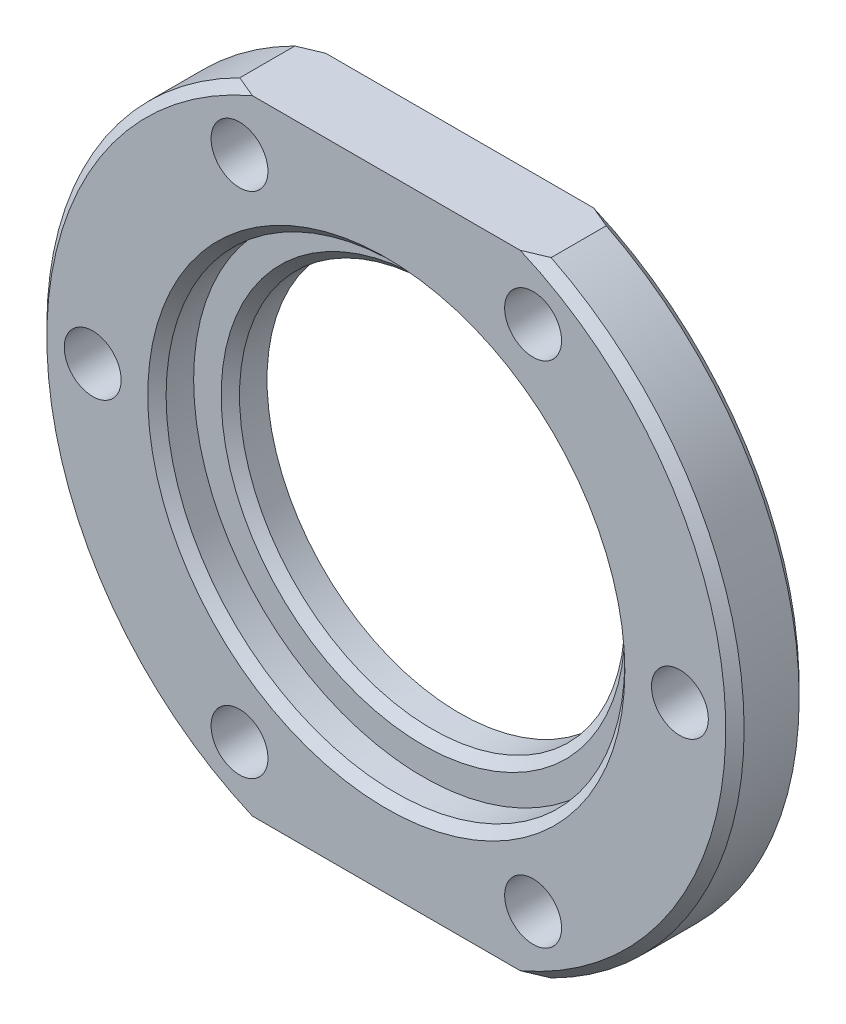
SolidWorks part; units mm, degrees
ref_plane "Front Plane" through (0, 0, 0) normal (0, 0, 1) x (1, 0, 0)
ref_plane "Top Plane" through (0, 0, 0) normal (0, 1, 0) x (1, 0, 0)
ref_plane "Right Plane" through (0, 0, 0) normal (1, 0, 0) x (0, 0, -1)
sketch "Sketch1" plane through (0, 0, 0) normal (0, 0, 1) x (1, 0, 0)
  line L0 (0, 0) -> (0, -19484.7512) construction
  line L1 (0, 0) -> (19484.7512, 0) construction
  line L2 (-8.485, 17) -> (8.485, 17)
  line L3 (-8.485, -17) -> (8.485, -17)
  arc A0 (8.485, -17) -> (8.485, 17) centre (0, 0) ccw
  arc A1 (-8.485, 17) -> (-8.485, -17) centre (0, 0) ccw
  point P11 (0, 0)
  point P12 (0, 0)
  dimension "D1" = 16.97
  dimension "D2" = 16.97
  dimension "D3" = 34
extrude "Boss-Extrude1" add sketch "Sketch1" along normal blind 4
sketch "Sketch2" plane through (0, 0, 4) normal (0, 0, 1) x (1, 0, 0)
  circle A0 centre (0, 0) radius 12.5
  point P3 (0, 0)
  dimension "D1" = 25
extrude "Cut-Extrude1" cut sketch "Sketch2" against normal blind 2
sketch "Sketch3" plane through (0, 0, 2) normal (0, 0, 1) x (1, 0, 0)
  circle A0 centre (0, 0) radius 10.5
  dimension "D1" = 21
extrude "Cut-Extrude2" cut sketch "Sketch3" against normal blind 12
sketch "Sketch4" plane through (0, 0, 4) normal (0, 0, 1) x (1, 0, 0)
  circle A0 centre (0, 0) radius 16 construction
  circle A1 centre (-16, 0) radius 1.55
  circle A2 centre (-8, 13.8564) radius 1.55
  circle A3 centre (8, 13.8564) radius 1.55
  circle A4 centre (16, 0) radius 1.55
  circle A5 centre (8, -13.8564) radius 1.55
  circle A6 centre (-8, -13.8564) radius 1.55
  point P17 (0, 0)
  dimension "D1" = 32
  dimension "D2" = 3.1
  dimension "D3" = 6
extrude "Cut-Extrude3" cut sketch "Sketch4" against normal blind 12
chamfer "Chamfer1" distance 0.5 angle 45 6 edges at (18.9999, 0, 0) (-18.9999, 0, 4) (10.5, 0, 2) (12.5, 0, 4) (-18.9999, 0, 0) (18.9999, 0, 4)
